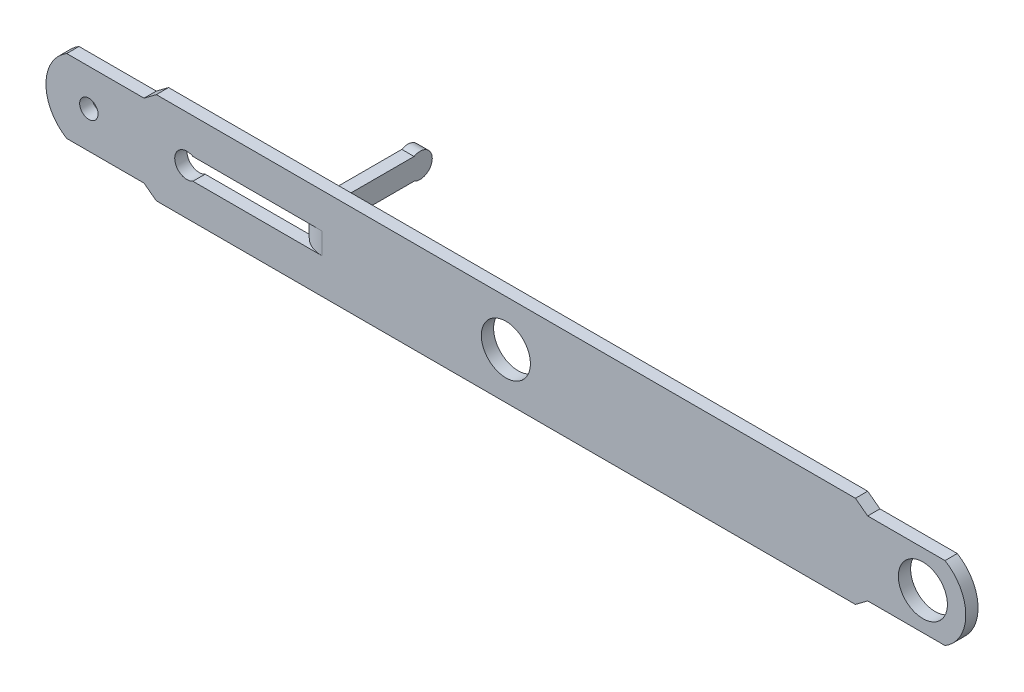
SolidWorks part; units mm, degrees
ref_plane "Face" through (0, 0, 0) normal (0, 0, 1) x (1, 0, 0)
ref_plane "Dessus" through (0, 0, 0) normal (0, 1, 0) x (1, 0, 0)
ref_plane "Droite" through (0, 0, 0) normal (1, 0, 0) x (0, 0, -1)
sketch "Esquisse1" plane through (0, 0, 0) normal (0, 0, 1) x (1, 0, 0)
  line L0 (-119.2721, 0) -> (123.1785, 0) construction
  line L1 (71.6056, 6) -> (59, 6)
  line L2 (59, 6) -> (57, 7.5)
  line L3 (57, 7.5) -> (-57, 7.5)
  line L4 (0, 0) -> (0, 31.7765) construction
  line L5 (-59, 6) -> (-57, 7.5)
  line L6 (-71.6056, 6) -> (-59, 6)
  line L7 (-71.6056, -6) -> (-59, -6)
  line L8 (-59, -6) -> (-57, -7.5)
  line L9 (57, -7.5) -> (-57, -7.5)
  line L10 (59, -6) -> (57, -7.5)
  line L11 (71.6056, -6) -> (59, -6)
  circle A0 centre (68, 0) radius 4
  arc A1 (71.6056, -6) -> (71.6056, 6) centre (68, 0) ccw
  arc A2 (-71.6056, -6) -> (-71.6056, 6) centre (-68, 0) cw
  circle A3 centre (-68, 0) radius 1.5
  circle A4 centre (0, 0) radius 4
  point P16 (0, 7.5)
  point P22 (0, -7.5)
  dimension "D1" = 8
  dimension "D2" = 14
  dimension "D8" = 8
  dimension "D9" = 3
  dimension "D3" = 12
  dimension "D4" = 15
  dimension "D5" = 9
  dimension "D6" = 2
  dimension "D7" = 136
extrude "Extrusion1" add sketch "Esquisse1" along normal blind 2
sketch "Esquisse2" plane through (0, 0, 0) normal (0, 0, -1) x (-1, 0, 0)
  line L0 (0, 0) -> (66.5, 0) construction
  line L1 (35, 1.75) -> (51.0318, 1.75)
  line L2 (35, -1.75) -> (51.0318, -1.75)
  line L3 (35, 1.75) -> (35, -1.75)
  circle A0 centre (68, 0) radius 1.5 construction
  arc A1 (51.0318, -1.75) -> (51.0318, 1.75) centre (52, 0) ccw
  dimension "D2" = 2
  dimension "D1" = 17
  dimension "D3" = 16
  dimension "D4" = 3.5
extrude "Enlèv. mat.-Extru.1" cut sketch "Esquisse2" against normal through all
sketch "Esquisse3" plane through (-35, 0, 0) normal (-1, 0, 0) x (0, 0, 1)
  line L0 (2, 1.75) -> (-16.0318, 1.75)
  line L1 (2, -1.75) -> (-16.0318, -1.75)
  line L2 (-17, 3) -> (-17, -3) construction
  line L3 (2, 1.75) -> (2, -1.75)
  line L4 (0, 1.75) -> (0, -1.75) construction
  arc A0 (-16.0318, 1.75) -> (-16.0318, -1.75) centre (-17, 0) ccw
  dimension "D2" = 4
  dimension "D1" = 17
extrude "Extrusion2" add sketch "Esquisse3" against normal blind 2
fillet "Congé1" radius 3
fillet "Congé2" radius 5
